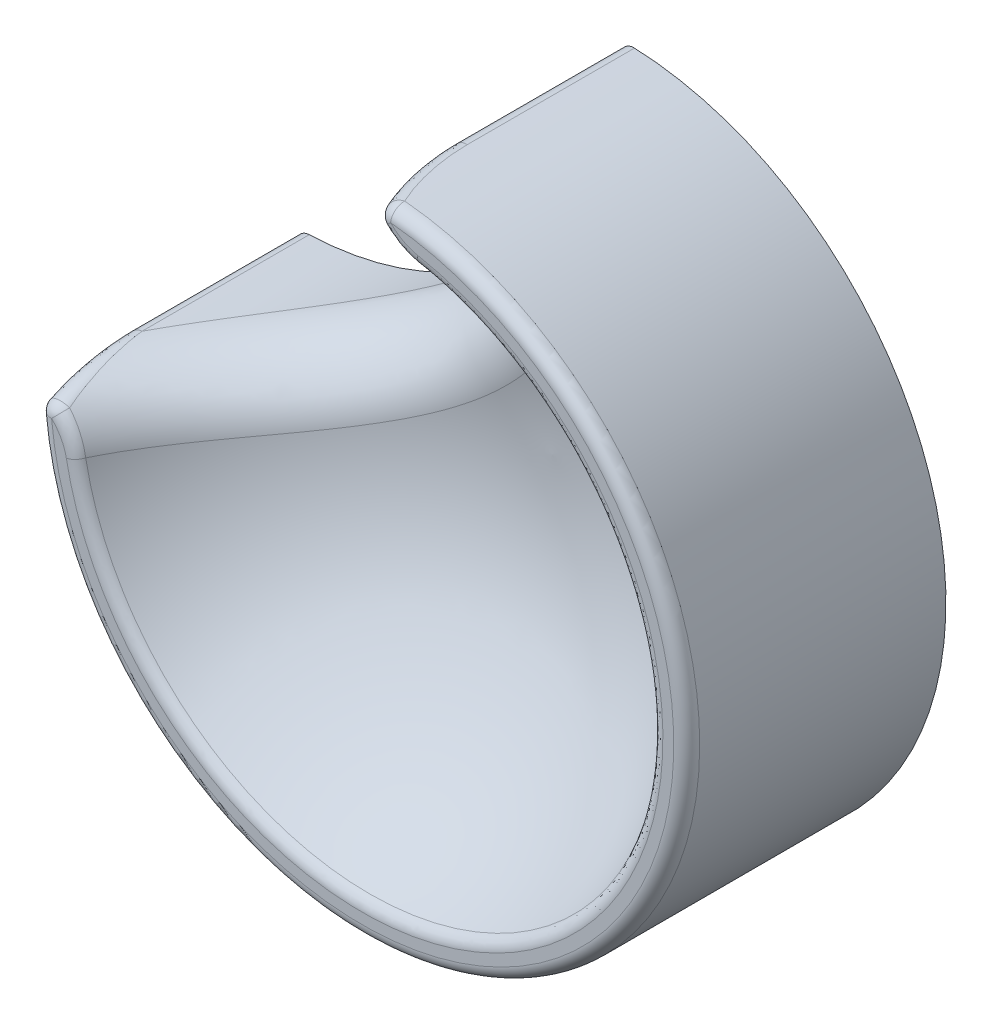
SolidWorks part; units mm, degrees
ref_plane "Front Plane" through (0, 0, 0) normal (0, 0, 1) x (1, 0, 0)
ref_plane "Top Plane" through (0, 0, 0) normal (0, 1, 0) x (1, 0, 0)
ref_plane "Right Plane" through (0, 0, 0) normal (1, 0, 0) x (0, 0, -1)
sketch "Sketch1" plane through (0, 0, 0) normal (0, 1, 0) x (1, 0, 0)
  line L0 (-25.0561, 25.0561) -> (0, 0) construction
  line L1 (0, 0) -> (-25.0561, 0) construction
  line L2 (-25.0561, 0) -> (-25.0561, 25.0561) construction
  arc A0 (-25.0561, 25.0561) -> (0, 0) centre (-25.0561, 0) ccw
  arc A1 (-25.0561, 25.0561) -> (0, 0) centre (-0.0561, 24.9999) ccw
extrude "Boss-Extrude2" add sketch "Sketch1" along normal blind 20 contours A1 A0
sketch "Sketch3" plane through (0, 20, 0) normal (0, 1, 0) x (1, 0, 0)
  line L0 (-25.0561, 0) -> (0, 0) construction
  line L1 (-25.0561, 0) -> (-25.0561, 25.0561) construction
  point P0 (-25.0561, 0)
sketch "Sketch4" plane through (0, 0, 0) normal (0, 0, 1) x (1, 0, 0)
  line L0 (-25.0561, 20) -> (0, 20) construction
  line L1 (-2.5, 20) -> (-25.0561, 20)
  line L2 (-25.0561, 20) -> (-25.0561, 5.2944)
  arc A0 (-2.5, 20) -> (-25.0561, 5.2944) centre (-24.4073, 28.9509) cw
  dimension "D1" = 2.5
revolve "Cut-Revolve1" cut sketch "Sketch4" angle 360 about L2
ref_plane "Plane1" through (2, 0, 0) normal (1, 0, 0) x (0, 0, -1)
sketch "Sketch6" plane through (2, 0, 0) normal (1, 0, 0) x (0, 0, -1)
  line L0 (0, 20) -> (0, 0) construction
fillet "Fillet6" radius 5 5 edges at (-12.3579, 20, -18.6422) (-16.1266, 7.5143, -5.8495) (-2.5001, 20, -0.0599) (-25.0275, 20, -23.8044) (-1.2517, 20, -0.0285)
fillet "Fillet8" radius 1 8 edges at (-27.6154, 20, -22.7568) (-1.4819, 20, 1.5036) (-12.3579, 20, -18.6422) (-42.7734, 20, 17.7173) (-25.0561, 7.3854, -25.0561) (0, 7.3853, 0)
move or copy body "Body-Move/Copy1" bodies to move or copy 107 copy no rotation origin (-19.9553, 15.1107, 4.8446) rotation axis (0.5774, 0.5774, 0.5774) rotation angle 120
